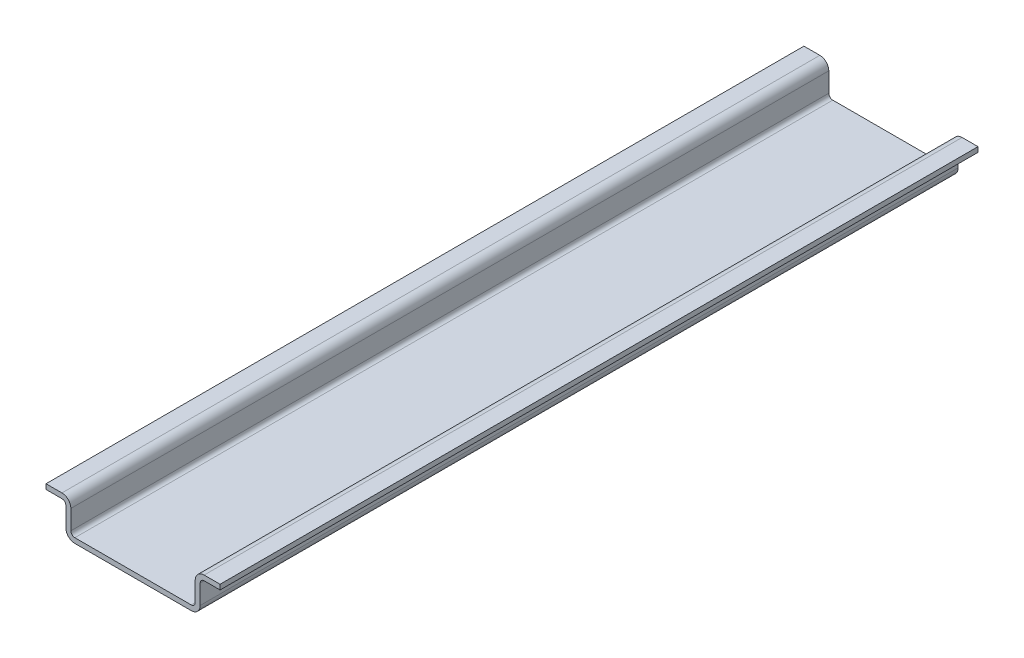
SolidWorks part; units mm, degrees
ref_plane "Front" through (0, 0, 0) normal (0, 0, 1) x (1, 0, 0)
ref_plane "Top" through (0, 0, 0) normal (0, 1, 0) x (1, 0, 0)
ref_plane "Right" through (0, 0, 0) normal (1, 0, 0) x (0, 0, -1)
sketch "Sketch1" plane through (0, 0, 0) normal (0, 0, 1) x (1, 0, 0)
  line L0 (-11.7, 1) -> (11.7, 1)
  line L1 (12.5, 1.8) -> (12.5, 5.7)
  line L2 (14.3, 7.5) -> (17.5, 7.5)
  line L3 (0, 0) -> (0, -22.1768) construction
  line L4 (14.3, 6.5) -> (17.5, 6.5)
  line L5 (13.5, 1.8) -> (13.5, 5.7)
  line L6 (-11.7, 0) -> (11.7, 0)
  line L7 (17.5, 7.5) -> (17.5, 6.5)
  line L8 (-17.5, 7.5) -> (-17.5, 6.5)
  line L9 (-13.5, 1.8) -> (-13.5, 5.7)
  line L10 (-14.3, 6.5) -> (-17.5, 6.5)
  line L11 (-14.3, 7.5) -> (-17.5, 7.5)
  line L12 (-12.5, 1.8) -> (-12.5, 5.7)
  arc A0 (11.7, 1) -> (12.5, 1.8) centre (11.7, 1.8) ccw
  arc A1 (12.5, 5.7) -> (14.3, 7.5) centre (14.3, 5.7) cw
  arc A2 (13.5, 5.7) -> (14.3, 6.5) centre (14.3, 5.7) cw
  arc A3 (11.7, 0) -> (13.5, 1.8) centre (11.7, 1.8) ccw
  arc A4 (-11.7, 0) -> (-13.5, 1.8) centre (-11.7, 1.8) cw
  arc A5 (-13.5, 5.7) -> (-14.3, 6.5) centre (-14.3, 5.7) ccw
  arc A6 (-12.5, 5.7) -> (-14.3, 7.5) centre (-14.3, 5.7) ccw
  arc A7 (-11.7, 1) -> (-12.5, 1.8) centre (-11.7, 1.8) cw
  point P28 (0, 1)
  dimension "D1" = 0.8
  dimension "D2" = 1.8
  dimension "D4" = 27
  dimension "D5" = 35
  dimension "D6" = 7.5
  dimension "D3" = 1
extrude "Extrude1" add sketch "Sketch1" along normal mid plane 152.4
sketch "Sketch2" plane through (0, 0, 0) normal (0, 0, 1) x (1, 0, 0)
  line L0 (-11.7, 0) -> (11.7, 0) construction
  line L1 (-32, 62) -> (32, 62) construction
  line L2 (-32, 62) -> (-32, 1) construction
  line L3 (-32, 1) -> (32, 1) construction
  line L4 (32, 62) -> (32, 1) construction
  line L5 (11.7, 1) -> (-11.7, 1) construction
  point P4 (0, 1)
  dimension "D1" = 62
  dimension "D2" = 64
